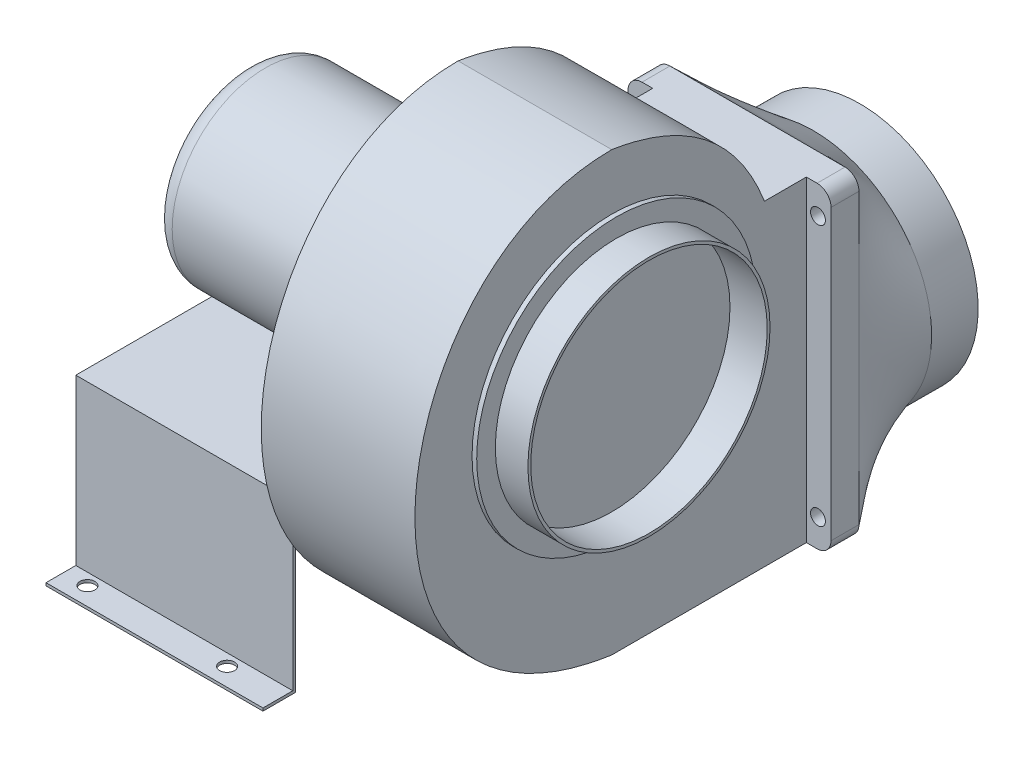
SolidWorks part; units mm, degrees
ref_plane "前视基准面" through (0, 0, 0) normal (0, 0, 1) x (1, 0, 0)
ref_plane "上视基准面" through (0, 0, 0) normal (0, 1, 0) x (1, 0, 0)
ref_plane "右视基准面" through (0, 0, 0) normal (1, 0, 0) x (0, 0, -1)
sketch "草图1" plane through (0, 0, 0) normal (1, 0, 0) x (0, 0, -1)
  line L5 (0, -260) -> (209, -260)
  line L6 (209, -260) -> (209, 80)
  line L7 (209, 80) -> (164, 80)
  spline S0 degree 3 poles (0, 210) (-249.4262, 210.2057) (-312.3657, -214.5714) (0, -260) knots 0 0 0 0 1 1 1 1
  spline S1 degree 2 poles (0, 210) (121.1072, 191.0175) (164, 80) knots 0 0 0 1 1 1
extrude "凸台-拉伸1" add sketch "草图1" along normal blind 165
sketch "草图2" plane through (0, 0, -209) normal (0, 0, -1) x (-1, 0, 0)
  line L4 (-176.5, -260) -> (11.5, -260)
  line L5 (-191.5, -245) -> (-191.5, 65)
  line L6 (-176.5, 80) -> (11.5, 80)
  line L7 (26.5, -245) -> (26.5, 65)
  line L8 (-191.5, -260) -> (26.5, 80) construction
  line L9 (-191.5, 80) -> (26.5, -260) construction
  arc A0 (-176.5, -260) -> (-191.5, -245) centre (-176.5, -245) cw
  arc A1 (11.5, -260) -> (26.5, -245) centre (11.5, -245) ccw
  arc A2 (11.5, 80) -> (26.5, 65) centre (11.5, 65) cw
  arc A3 (-191.5, 65) -> (-176.5, 80) centre (-176.5, 65) cw
  point P6 (-82.5, -90)
  dimension "D1" = 15
extrude "凸台-拉伸2" add sketch "草图2" along normal blind 30
sketch "草图3" plane through (0, 0, -239) normal (0, 0, -1) x (-1, 0, 0)
  circle A0 centre (-177.5, 50) radius 8
  circle A1 centre (12.5, 50) radius 8
  circle A2 centre (12.5, -230) radius 8
  circle A3 centre (-177.5, -230) radius 8
  point P6 (-82.5, -90)
extrude "切除-拉伸1" cut sketch "草图3" against normal blind 30
sketch "草图4" plane through (0, 0, -239) normal (0, 0, -1) x (-1, 0, 0)
  line L4 (-162.5, -217) -> (-2.5, -217)
  line L5 (-162.5, -217) -> (-162.5, 37)
  line L6 (-162.5, 37) -> (-2.5, 37)
  line L7 (-2.5, -217) -> (-2.5, 37)
  line L8 (-162.5, -217) -> (-2.5, 37) construction
  line L9 (-162.5, 37) -> (-2.5, -217) construction
  point P6 (-82.5, -90)
extrude "切除-拉伸2" cut sketch "草图4" against normal blind 300
sketch "草图5" plane through (0, 0, -239) normal (0, 0, -1) x (-1, 0, 0)
  line L1 (-165, 80) -> (0, 80) construction
  line L4 (-176.5, -260) -> (11.5, -260)
  line L5 (-191.5, -245) -> (-191.5, 65)
  line L6 (-176.5, 80) -> (11.5, 80)
  line L7 (26.5, -245) -> (26.5, 65)
  line L8 (-191.5, -260) -> (26.5, 80) construction
  line L9 (-191.5, 80) -> (26.5, -260) construction
  arc A0 (-176.5, -260) -> (-191.5, -245) centre (-176.5, -245) cw
  arc A1 (11.5, -260) -> (26.5, -245) centre (11.5, -245) ccw
  arc A2 (11.5, 80) -> (26.5, 65) centre (11.5, 65) cw
  arc A3 (-191.5, 65) -> (-176.5, 80) centre (-176.5, 65) cw
  point P7 (-82.5, -90)
  dimension "D1" = 15
ref_plane "基准面1" through (0, 0, -299) normal (0, 0, 1) x (1, 0, 0)
sketch "草图7" plane through (0, 0, -299) normal (0, 0, 1) x (1, 0, 0)
  circle A0 centre (82.5, -90) radius 127
loft "放样5" add profiles "草图5", "草图7"
sketch "草图8" plane through (0, 0, -299) normal (0, 0, -1) x (-1, 0, 0)
  circle A0 centre (-82.5, -90) radius 105
extrude "切除-拉伸3" cut sketch "草图8" against normal blind 60
sketch "草图11" plane through (0, 0, -299) normal (0, 0, -1) x (-1, 0, 0)
  circle A0 centre (-82.5, -90) radius 127
  circle A1 centre (-82.5, -90) radius 105
extrude "凸台-拉伸4" add sketch "草图11" along normal blind 50
sketch "草图12" plane through (0, 0, -349) normal (0, 0, -1) x (-1, 0, 0)
  circle A0 centre (-82.5, -90) radius 105
  circle A1 centre (-82.5, -90) radius 122
extrude "切除-拉伸4" cut sketch "草图12" against normal blind 65
sketch "草图13" plane through (165, 0, 0) normal (1, 0, 0) x (0, 0, -1)
  circle A0 centre (0, 0) radius 130
  circle A1 centre (0, 0) radius 150
extrude "凸台-拉伸5" add sketch "草图13" along normal blind 5
sketch "草图14" plane through (165, 0, 0) normal (1, 0, 0) x (0, 0, -1)
  circle A0 centre (0, 0) radius 130
  circle A1 centre (0, 0) radius 127
extrude "凸台-拉伸6" add sketch "草图14" along normal blind 40
sketch "草图15" plane through (0, 0, 0) normal (-1, 0, 0) x (0, 0, 1)
  circle A0 centre (0, 0) radius 100
extrude "凸台-拉伸7" add sketch "草图15" along normal blind 227
fillet "圆角1" radius 20 1 edges at (-227, 0, 100)
sketch "草图16" plane through (0, 0, 0) normal (-1, 0, 0) x (0, 0, 1)
  line L2 (-177.5, -110) -> (177.5, -110)
  line L4 (-177.5, -110) -> (-177.5, -287)
  line L5 (-177.5, -287) -> (-209.5, -287)
  line L6 (-209.5, -287) -> (-209.5, -290)
  line L7 (-209.5, -290) -> (-174.5, -290)
  line L8 (-174.5, -290) -> (-174.5, -113)
  line L9 (-174.5, -113) -> (174.5, -113)
  line L10 (174.5, -113) -> (174.5, -290)
  line L11 (174.5, -290) -> (209.5, -290)
  line L12 (177.5, -110) -> (177.5, -287)
  line L13 (177.5, -287) -> (209.5, -287)
  line L14 (209.5, -287) -> (209.5, -290)
extrude "凸台-拉伸8" add sketch "草图16" along normal blind 233
sketch "草图18" plane through (0, -290, 0) normal (0, -1, 0) x (1, 0, 0)
  circle A0 centre (-208, 190) radius 8
  circle A1 centre (-58, 190) radius 8
  circle A2 centre (-58, -190) radius 8
  circle A3 centre (-208, -190) radius 8
extrude "切除-拉伸5" cut sketch "草图18" against normal blind 3
